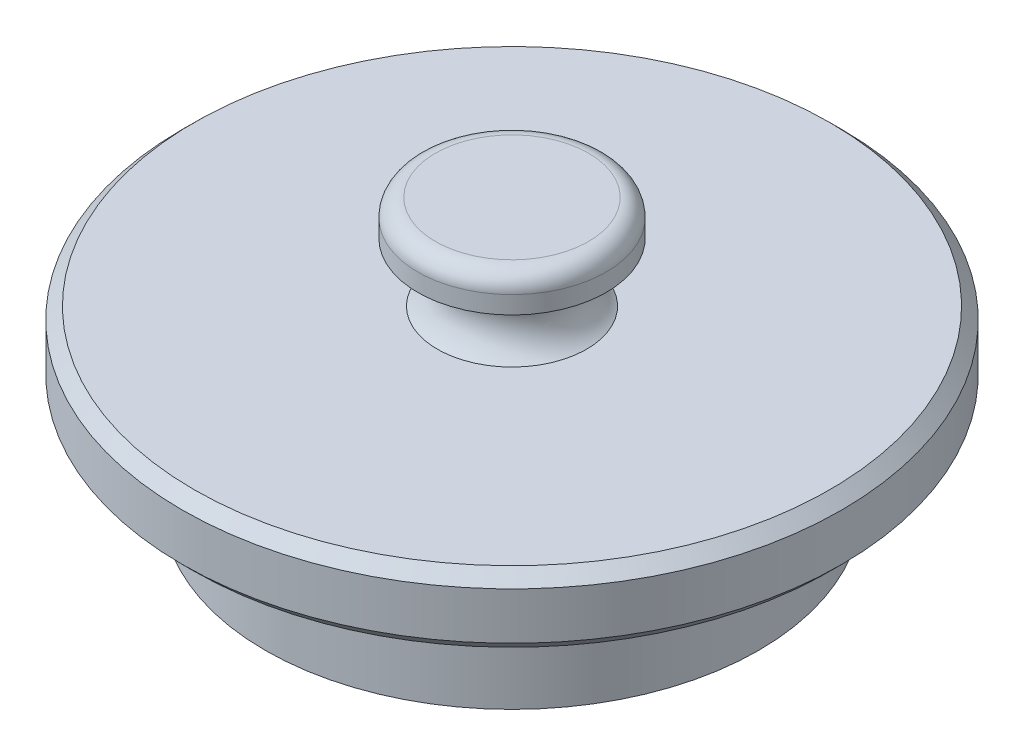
SolidWorks part; units mm, degrees
ref_plane "Face" through (0, 0, 0) normal (0, 0, 1) x (1, 0, 0)
ref_plane "Dessus" through (0, 0, 0) normal (0, 1, 0) x (1, 0, 0)
ref_plane "Côté" through (0, 0, 0) normal (1, 0, 0) x (0, 0, -1)
sketch "Esquisse1" plane through (0, 0, 0) normal (0, 0, 1) x (1, 0, 0)
  line L0 (0, -3.794) -> (0, 62.0588) construction
  line L1 (0, 12) -> (-3.25, 12)
  line L2 (-4, 11.25) -> (-4, 10.5)
  line L3 (-4, 10.5) -> (-3.1708, 10.5)
  line L4 (-3.1708, 8) -> (-14, 8)
  line L5 (-14, 8) -> (-14, 5)
  line L6 (-14, 5) -> (-10.4775, 5)
  line L7 (-10.4775, 5) -> (-10.4775, 0)
  line L8 (-10.4775, 0) -> (0, 0)
  line L9 (0, 0) -> (0, 12)
  arc A0 (-3.1708, 10.5) -> (-3.1708, 8) centre (-4, 9.25) cw
  arc A1 (-4, 11.25) -> (-3.25, 12) centre (-3.25, 11.25) cw
  dimension "D5" = 20.955
  dimension "D4" = 2.5
  dimension "D8" = 1.5
  dimension "D10" = 0.75
  dimension "D1" = 1.5
  dimension "D2" = 3
  dimension "D3" = 5
  dimension "D6" = 28
  dimension "D7" = 8
  dimension "D9" = 5
revolve "Révolution exter" add sketch "Esquisse1"
chamfer "Chanfrein2" distance 1 angle 30 1 edges at (0, 0, -10.4775)
hole_wizard "Perçage1" positions "Esquisse4" profile "Esquisse3" hole size "M1" standard "ISO"
sketch "Esquisse4" plane through (0, 0, 0) normal (0, -1, 0) x (1, 0, 0)
  point P0 (0, 0)
sketch "Esquisse3" plane through (0, 0, 0) normal (1, 0, 0) x (0, 0, -1)
  line L0 (0, 0) -> (0, 7.5065)
  line L1 (0, 7.5065) -> (7.5, 3)
  line L2 (7.5, 3) -> (7.5, 0)
  line L5 (7.5, 0) -> (0, 0)
  line L10 (0, 7.5065) -> (-7.5, 3) construction
  line L11 (0, -6.35) -> (0, 107.95) construction
  dimension "Diamètre du perçage" = 15
  dimension "Profondeur du perçage" = 3
  dimension "Angle de pointe" = 118
chamfer "Chanfrein1" distance 0.5 angle 45 2 edges at (0, 8, -14) (0, 5, -14)
